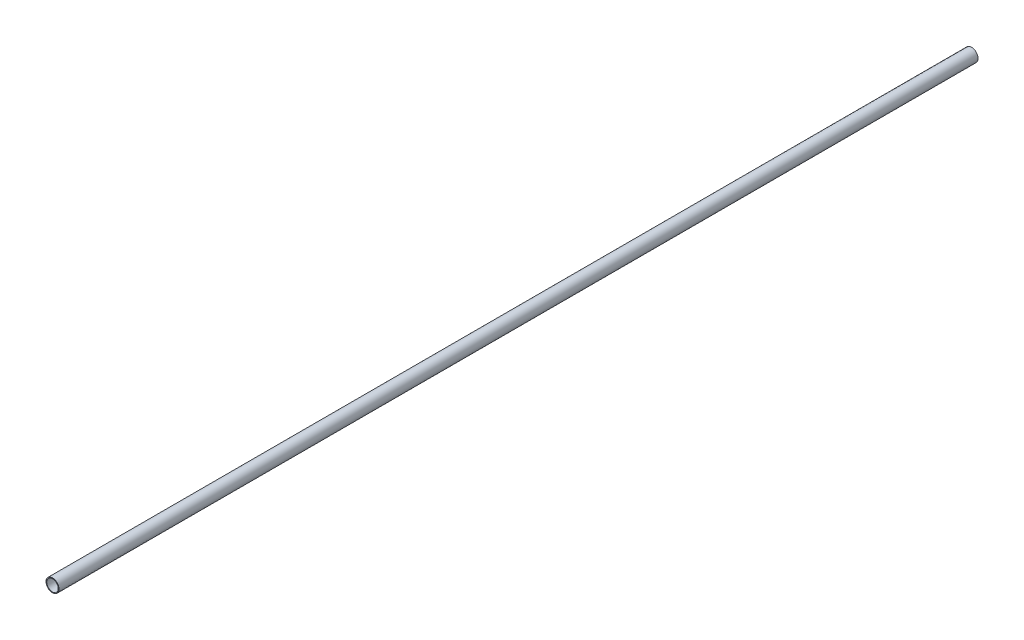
SolidWorks part; units mm, degrees
ref_plane "Plan de face" through (0, 0, 0) normal (0, 0, 1) x (1, 0, 0)
ref_plane "Plan de dessus" through (0, 0, 0) normal (0, 1, 0) x (1, 0, 0)
ref_plane "Plan de droite" through (0, 0, 0) normal (1, 0, 0) x (0, 0, -1)
sketch "Esquisse1" plane through (0, 0, 0) normal (0, 0, 1) x (1, 0, 0)
  circle A0 centre (0, 0) radius 12.5
  dimension "D1" = 25
extrude "Extru.-Mince1" add sketch "Esquisse1" along normal blind 1990 thin
